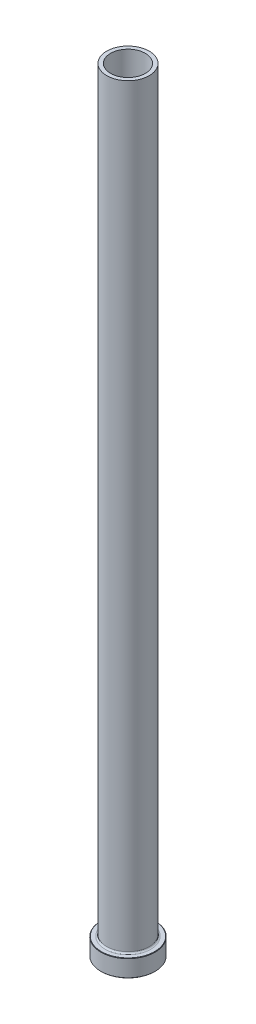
SolidWorks part; units mm, degrees
ref_plane "Front Plane" through (0, 0, 0) normal (0, 0, 1) x (1, 0, 0)
ref_plane "Top Plane" through (0, 0, 0) normal (0, 1, 0) x (1, 0, 0)
ref_plane "Right Plane" through (0, 0, 0) normal (1, 0, 0) x (0, 0, -1)
sketch "Sketch1" plane through (0, 0, 0) normal (0, 0, 1) x (1, 0, 0)
  line L0 (-9, 400) -> (-11, 400)
  line L1 (-11, 400) -> (-11, 9)
  line L2 (-11, 9) -> (-14, 9)
  line L3 (-14, 9) -> (-14, 0)
  line L4 (15.4, 0) -> (-15.4, 0) construction
  line L5 (-14, 0) -> (-9.25, 0)
  line L6 (-9, 345) -> (-9, 400)
  line L7 (0, 92.1877) -> (0, -15.5353) construction
  line L8 (0, -15.4) -> (0, 15.4) construction
  line L9 (-9, 345) -> (-9.25, 333)
  line L10 (-9.25, 333) -> (-9.25, 0)
  dimension "D1" = 0.25
  dimension "ID" = 18
  dimension "OD" = 22
  dimension "L" = 400
  dimension "H" = 28
  dimension "T" = 9
  dimension "N" = 55
  dimension "D2" = 12
revolve "Revolve1" add sketch "Sketch1" angle 360 about L7
fillet "Fillet1" radius 0.8 1 edges at (0, 9, 11)
chamfer "Chamfer1" distance 0.2 angle 45 2 edges at (0, 9, 14) (0, 0, 14)
chamfer "Chamfer3" distance 0.5 angle 45 1 edges at (0, 0, 9.25)
